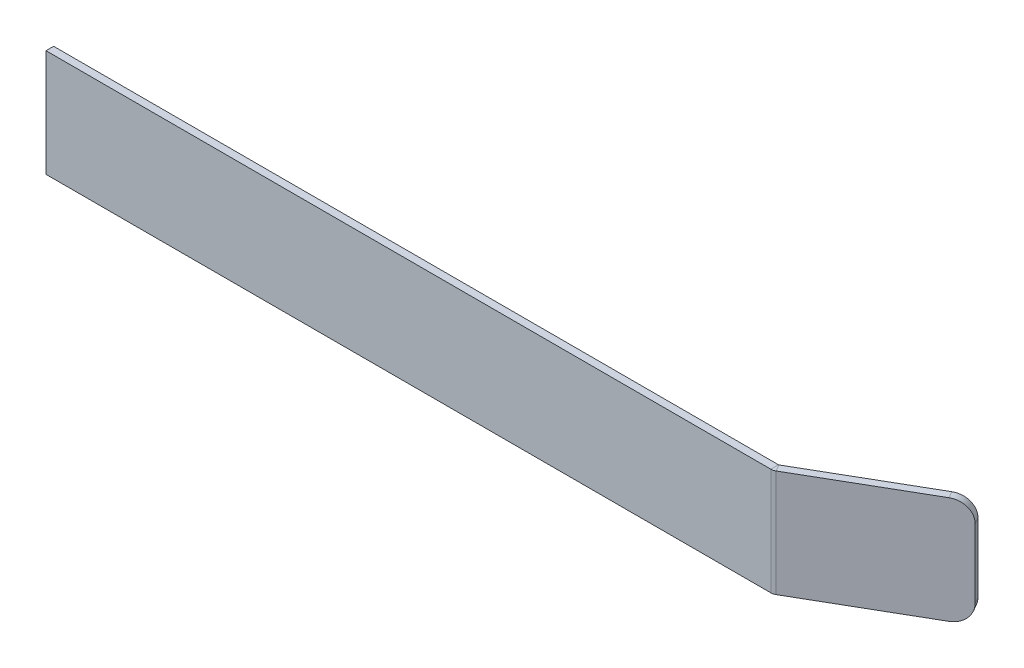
SolidWorks part; units mm, degrees
ref_plane "Plan de face" through (0, 0, 0) normal (0, 0, 1) x (1, 0, 0)
ref_plane "Plan de dessus" through (0, 0, 0) normal (0, 1, 0) x (1, 0, 0)
ref_plane "Plan de droite" through (0, 0, 0) normal (1, 0, 0) x (0, 0, -1)
sketch "Esquisse1" plane through (0, 0, 0) normal (0, 0, 1) x (1, 0, 0)
  line L1 (0, 0) -> (1141, 0)
  line L2 (0, 0) -> (0, 140)
  line L3 (0, 140) -> (1141, 140)
  line L4 (1141, 0) -> (1141, 140)
  dimension "D1" = 1141
  dimension "D2" = 140
sheet metal parameters "Tôlerie 1" thickness 10 parameters "D1"=0.7366, "Epaisseur"=10
base flange "Tôle de base pliée1" sketch "Esquisse1" thickness 10 reverse thickness direction yes parameters "D1"=0.7366
sketch "Esquisse3" plane through (0, 0, 0) normal (0, 0, -1) x (-1, 0, 0)
  line L0 (-949, 0) -> (-949, 140)
  line L1 (0, 0) -> (-1141, 0) construction
  line L2 (-1141, 140) -> (0, 140) construction
  line L3 (-1141, 0) -> (-1141, 140) construction
  dimension "D1" = 192
sketched bend "Pli esquissé1" parameters "D1"=0.7366
bend "Pli esquissé2" bend radius 0.7366 bend angle 30 parameters "D5"=1
fillet "Congé1" radius 25 2 edges at (1115.3427, 140, -91.0176) (1115.3427, 0, -91.0176)
flat pattern "Etat déplié1"
sketch "Lignes de pliage1" plane through (0, 0, 0) normal (0, 1, 0) x (-1, 0, 0)
bend of the flat pattern "Dépliage-<Pli esquissé2>1"
